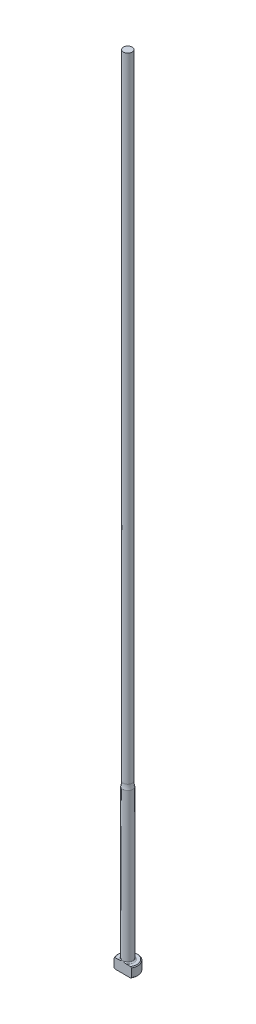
SolidWorks part; units mm, degrees
ref_plane "Front Plane" through (0, 0, 0) normal (0, 0, 1) x (1, 0, 0)
ref_plane "Top Plane" through (0, 0, 0) normal (0, 1, 0) x (1, 0, 0)
ref_plane "Right Plane" through (0, 0, 0) normal (1, 0, 0) x (0, 0, -1)
sketch "Sketch1" plane through (0, 0, 0) normal (0, 0, 1) x (1, 0, 0)
  line L0 (0, 259.9588) -> (0, -15.1925) construction
  line L1 (0, 0) -> (-3.175, 0)
  line L2 (-3.175, 0) -> (-3.175, 3.175)
  line L3 (-3.175, 3.175) -> (-1.5875, 3.175)
  line L4 (-1.3881, 52.3788) -> (-1.3881, 254)
  line L5 (-1.3881, 254) -> (0, 254)
  line L6 (0, 254) -> (0, 0)
  line L7 (-1.5875, 3.175) -> (-1.5875, 50.8)
  arc A0 (-1.5875, 50.8) -> (-1.3881, 52.3788) centre (-7.7381, 52.3788) ccw
  point P13 (-1.5875, 0)
  dimension "D1" = 6.35
  dimension "L" = 254
  dimension "D2" = 3.175
  dimension "H" = 6.35
  dimension "T" = 3.175
  dimension "D" = 2.7762
  dimension "S" = 50.8
revolve "Revolve1" add sketch "Sketch1" angle 360 about L0
chamfer "Chamfer1" distance 0.254 angle 45 2 edges at (0, 3.175, 3.175) (0, 0, 3.175)
fillet "Fillet1" radius 0.381 1 edges at (0, 3.175, 1.5875)
sketch "Sketch2" plane through (0, 0, 0) normal (0, -1, 0) x (1, 0, 0)
  line L0 (-2.7496, 1.5875) -> (2.7496, 1.5875)
  arc A0 (2.7496, 1.5875) -> (-2.7496, 1.5875) centre (0, 0) ccw
  circle A1 centre (0, 0) radius 3.175 construction
  circle A2 centre (0, 0) radius 1.5875 construction
extrude "Cut-Extrude1" cut sketch "Sketch2" against normal through all
